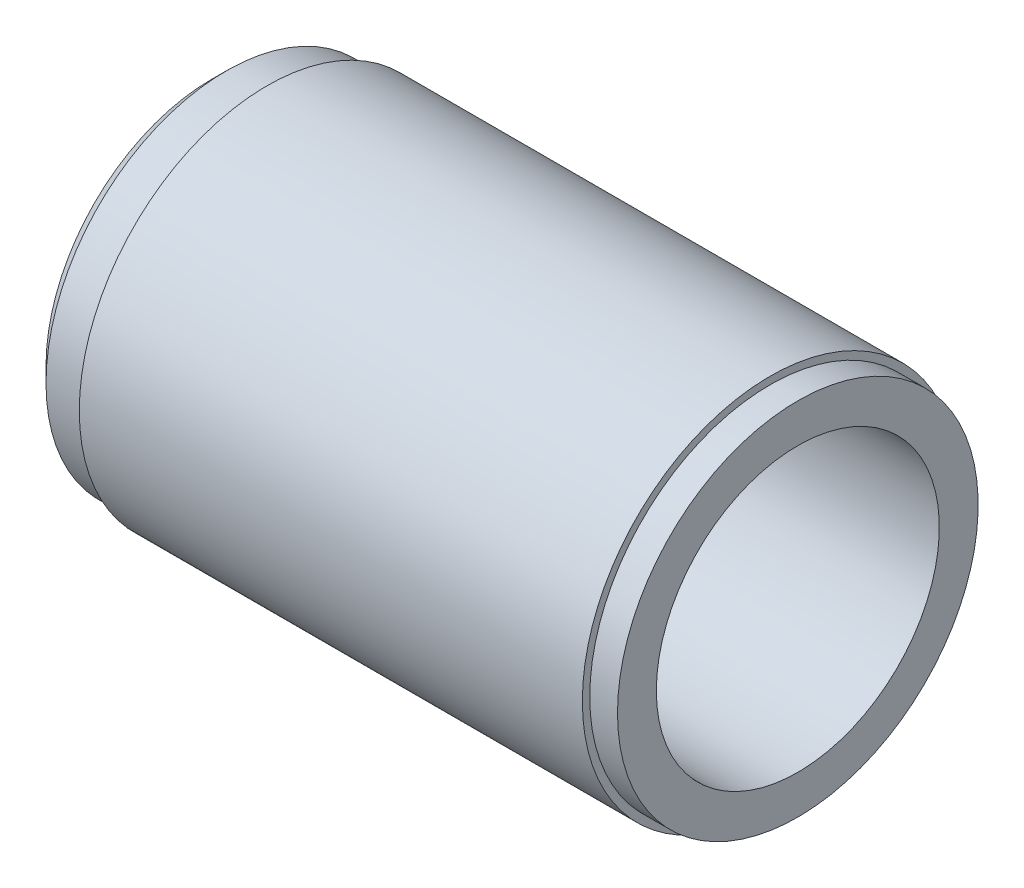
SolidWorks part; units mm, degrees
ref_plane "Plan de face" through (0, 0, 0) normal (0, 0, 1) x (1, 0, 0)
ref_plane "Plan de dessus" through (0, 0, 0) normal (0, 1, 0) x (1, 0, 0)
ref_plane "Plan de droite" through (0, 0, 0) normal (1, 0, 0) x (0, 0, -1)
sketch "Esquisse1" plane through (0, 0, 0) normal (0, 0, 1) x (1, 0, 0)
  line L0 (0, 0) -> (391.1177, 0) construction
  line L1 (0, 76.5) -> (0, 89.5)
  line L2 (8, 97.5) -> (30, 97.5)
  line L3 (30, 97.5) -> (30, 101.5)
  line L4 (30, 101.5) -> (302, 101.5)
  line L5 (302, 101.5) -> (302, 97.5)
  line L6 (302, 97.5) -> (317, 97.5)
  line L7 (317, 97.5) -> (317, 76.5)
  line L8 (317, 76.5) -> (0, 76.5)
  line L9 (0, 89.5) -> (8, 97.5)
  point P3 (0, 97.5)
  dimension "D1" = 203
  dimension "D2" = 317
  dimension "D3" = 153
  dimension "D4" = 30
  dimension "D5" = 272
  dimension "D6" = 195
  dimension "D9" = 8
revolve "Révolution1" add sketch "Esquisse1" angle 360 about L0
